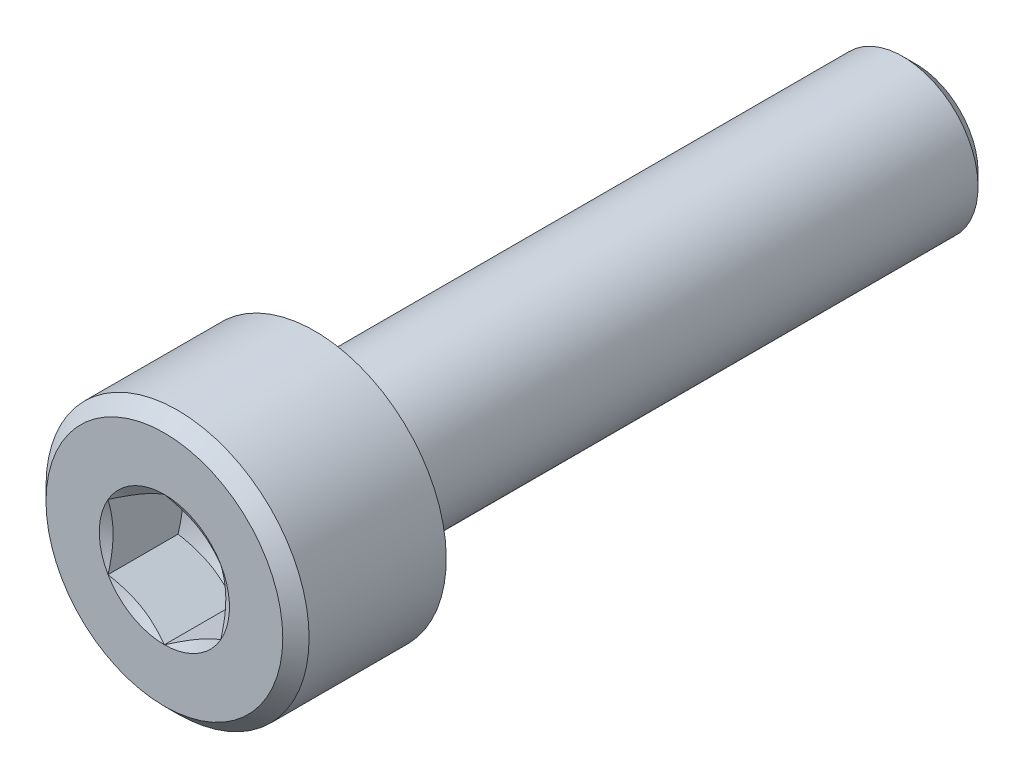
SolidWorks part; units mm, degrees
ref_plane "Front" through (0, 0, 0) normal (0, 0, 1) x (1, 0, 0)
ref_plane "Top" through (0, 0, 0) normal (0, 1, 0) x (1, 0, 0)
ref_plane "Right" through (0, 0, 0) normal (1, 0, 0) x (0, 0, -1)
sketch "Sketch1" plane through (0, 0, 0) normal (1, 0, 0) x (0, 0, -1)
  line L0 (0, 3.5) -> (-4, 3.5)
  line L1 (-4, 3.5) -> (-4, 0)
  line L2 (-4, 0) -> (16, 0)
  line L3 (16, 0) -> (16, 2)
  line L4 (16, 2) -> (0, 2)
  line L5 (0, 2) -> (0, 3.5)
  line L6 (0, 0) -> (12.7561, 0) construction
  dimension "l" = 16
  dimension "d" = 4
  dimension "k" = 4
  dimension "dk" = 7
revolve "Revolve1" add sketch "Sketch1" angle 360 about L2
sketch "Sketch7" plane through (0, 0, 0) normal (1, 0, 0) x (0, 0, -1)
  line L0 (-6.6396, 0) -> (3.6195, 0) construction
  line L1 (-4, 0) -> (-4, 1.5)
  line L2 (-4, 3.5) -> (-4, -3.5) construction
  line L3 (-4, 1.5) -> (-2, 1.5)
  line L4 (-2, 1.5) -> (-1.134, 0)
  line L6 (-4, 0) -> (-1.134, 0)
  dimension "D1" = 60
  dimension "S" = 3
  dimension "t" = 2
revolve "Cut-Revolve2" cut sketch "Sketch7" angle 360 about L6
chamfer "Chamfer1" distance 0.35 2 edges at (0, -2, -16) (0, -3.5, 4)
sketch "Sketch8" plane through (0, 0, 4) normal (0, 0, 1) x (1, 0, 0)
  line L1 (0, 1.7321) -> (-1.5, 0.866)
  line L2 (-1.5, 0.866) -> (-1.5, -0.866)
  line L3 (-1.5, -0.866) -> (0, -1.7321)
  line L4 (0, -1.7321) -> (1.5, -0.866)
  line L5 (1.5, -0.866) -> (1.5, 0.866)
  line L6 (1.5, 0.866) -> (0, 1.7321)
  circle A0 centre (0, 0) radius 1.5 construction
  circle A1 centre (0, 0) radius 1.5 construction
extrude "Cut-Extrude1" cut sketch "Sketch8" against normal up to surface (1.866 mm away)
sketch "Sketch9" plane through (0, 0, 0) normal (1, 0, 0) x (0, 0, -1)
  line L0 (-4, 1.5) -> (4.2695, 1.5) construction
  line L3 (-4.5, 2.5981) -> (-4.5, 1.5)
  line L4 (-4.5, 1.5) -> (-3.866, 1.5)
  line L5 (-3.866, 1.5) -> (-4.5, 2.5981)
  line L6 (-4, 3.5) -> (-4, -3.5) construction
  dimension "D1" = 60
  dimension "D2" = 0.5
revolve "Cut-Revolve3" cut sketch "Sketch9" angle 360 about axis through (0, 0, 4) along (0, 0, -1)
fillet "Fillet2" radius 0.4 1 edges at (0, -2, 0)
